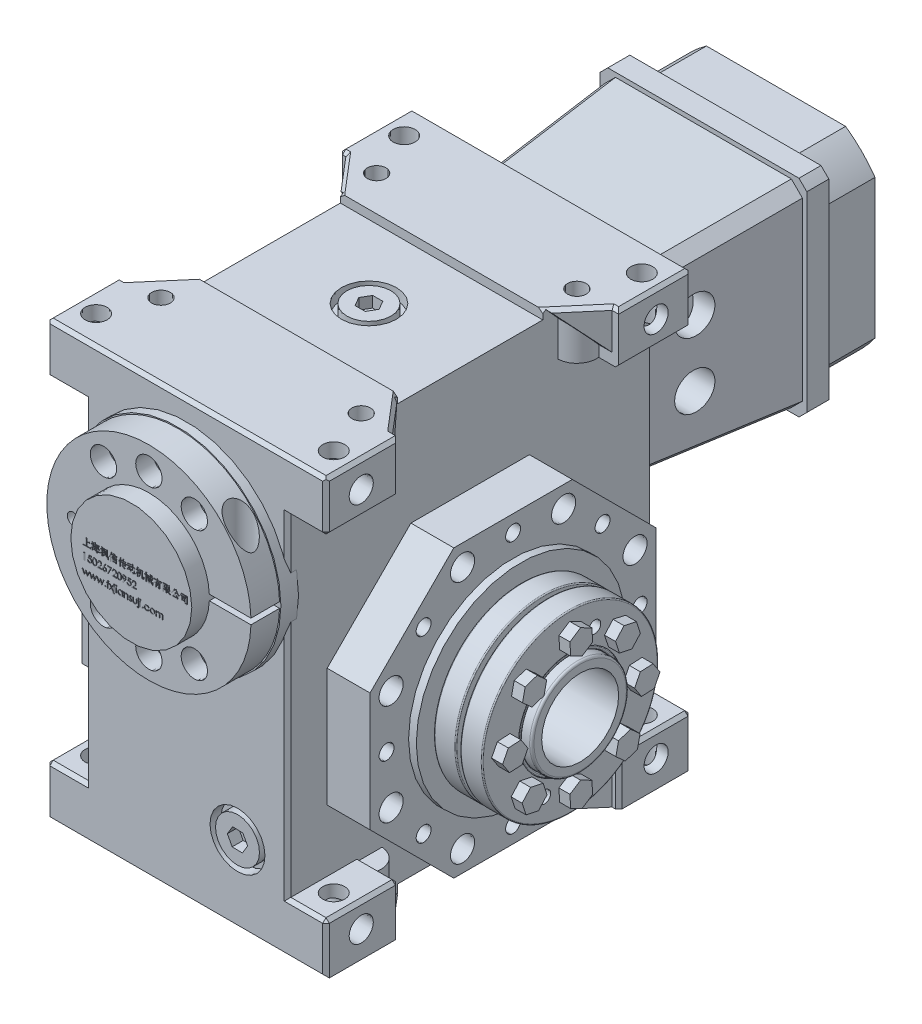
SolidWorks part; units mm, degrees
ref_plane "前视基准面" through (0, 0, 0) normal (0, 0, 1) x (1, 0, 0)
ref_plane "上视基准面" through (0, 0, 0) normal (0, 1, 0) x (1, 0, 0)
ref_plane "右视基准面" through (0, 0, 0) normal (1, 0, 0) x (0, 0, -1)
imported_body "JDLB063-CR箱体-1-solid1"
imported_body "JDLB063-CR箱体-1-solid2"
imported_body "JDLB063-C1空心轴Φ35-1-solid1"
imported_body "JDLB063-ST94输入法兰-1-solid1"
imported_body "JDLB063-C1锁紧盘-44-80-25-1-solid1"
imported_body "JDLB063-C1锁紧盘-44-80-25-1-solid2"
imported_body "JDLB063-C1锁紧盘-44-80-25-1-solid3"
imported_body "ST90-70-90-M6伺服法兰接口-1-solid1"
imported_body "联轴器BD56-60-20-19锁紧-1-solid1"
imported_body "联轴器BD56-60-20-19锁紧-1-solid2"
imported_body "联轴器BD56-60-20-19锁紧-1-solid3"
imported_body "联轴器BD56-60-20-19锁紧-1-solid4"
imported_body "联轴器BD56-60-20-19锁紧-1-solid5"
imported_body "联轴器BD56-60-20-19锁紧-1-solid6"
imported_body "联轴器BD56-60-20-19锁紧-1-solid7"
imported_body "联轴器BD56-60-20-19锁紧-1-solid8"
imported_body "联轴器BD56-60-20-19锁紧-1-solid9"
imported_body "联轴器BD56-60-20-19锁紧-1-solid10"
imported_body "联轴器BD56-60-20-19锁紧-1-solid11"
sketch "草图1" plane through (47, 0, 0) normal (1, 0, 0) x (0, 0, -1)
  line L1 (-30.6476, 103.2216) -> (30.9944, 103.2216)
  line L2 (-30.6476, 103.2216) -> (-30.6476, 86.6134)
  line L3 (-30.6476, 86.6134) -> (30.9944, 86.6134)
  line L4 (30.9944, 103.2216) -> (30.9944, 86.6134)
extrude "切除-拉伸1" cut sketch "草图1" against normal up to surface (1 mm away)
sketch "草图2" plane through (-47, 0, 0) normal (-1, 0, 0) x (0, 0, 1)
  line L1 (-27.2366, 101.1404) -> (24.4455, 101.1404)
  line L2 (-27.2366, 101.1404) -> (-27.2366, 86.1653)
  line L3 (-27.2366, 86.1653) -> (24.4455, 86.1653)
  line L4 (24.4455, 101.1404) -> (24.4455, 86.1653)
extrude "切除-拉伸2" cut sketch "草图2" against normal up to surface (1 mm away)
sketch "草图3" plane through (0, 0, 108) normal (0, 0, 1) x (1, 0, 0)
  text T0 "上海枫信传动机械有限公司  15026720952  www.fxjiansuji.com" font "Century Gothic" height in points 11
extrude "凸台-拉伸1" add sketch "草图3" along normal blind 0.2
